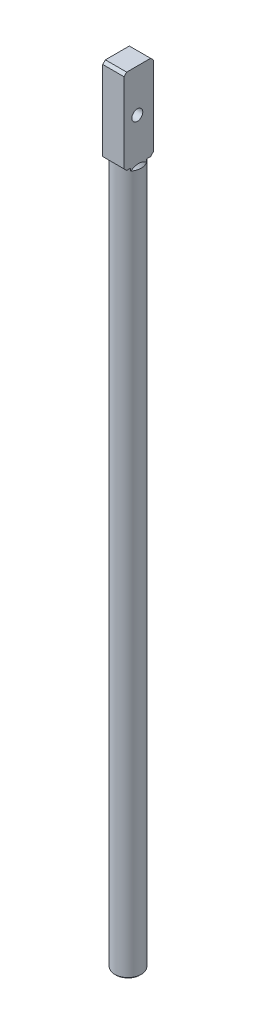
SolidWorks part; units mm, degrees
ref_plane "Front Plane" through (0, 0, 0) normal (0, 0, 1) x (1, 0, 0)
ref_plane "Top Plane" through (0, 0, 0) normal (0, 1, 0) x (1, 0, 0)
ref_plane "Right Plane" through (0, 0, 0) normal (1, 0, 0) x (0, 0, -1)
sketch "Sketch1" plane through (0, 0, 0) normal (0, 1, 0) x (1, 0, 0)
  circle A0 centre (0, 0) radius 5
  dimension "D1" = 10
extrude "Extrude3" add sketch "Sketch1" along normal blind 264
sketch "Sketch2" plane through (0, 264, 0) normal (0, 1, 0) x (1, 0, 0)
  line L1 (-4, -5.5) -> (4, -5.5)
  line L2 (-4, -5.5) -> (-4, 5.5)
  line L3 (-4, 5.5) -> (4, 5.5)
  line L4 (4, -5.5) -> (4, 5.5)
  line L5 (-4, -5.5) -> (4, 5.5) construction
  line L6 (-4, 5.5) -> (4, -5.5) construction
  point P0 (0, 0)
  dimension "D1" = 11
  dimension "D2" = 8
extrude "Extrude4" add sketch "Sketch2" along normal blind 32
chamfer "Chamfer1" distance 1 angle 45 6 edges at (5, 264, 0) (-5, 264, 0) (0, 264, 5.5) (0, 264, -5.5) (0, 296, 5.5) (0, 296, -5.5)
chamfer "Chamfer3" distance 0.5 angle 45 1 edges at (0, 0, 5)
sketch "Sketch5" plane through (-4, 0, 0) normal (-1, 0, 0) x (0, 0, 1)
  line L0 (-4.5, 296) -> (4.5, 296) construction
  line L1 (5.5, 295) -> (5.5, 265) construction
  circle A0 centre (0.5, 280) radius 2.05
  dimension "D2" = 4.1
  dimension "D1" = 16
  dimension "D3" = 5
extrude "Extrude5" cut sketch "Sketch5" against normal through all
